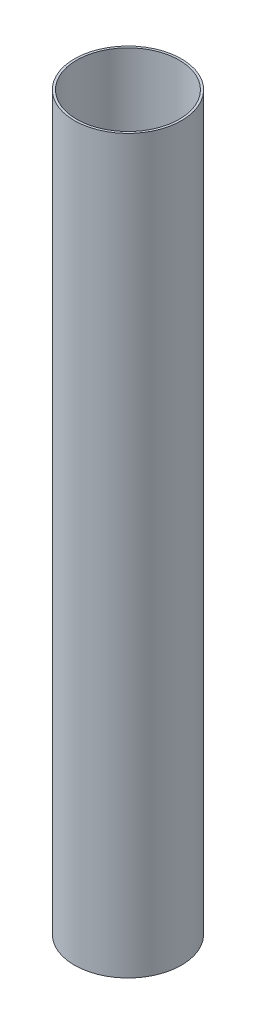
SolidWorks part; units mm, degrees
ref_plane "Front Plane" through (0, 0, 0) normal (0, 0, 1) x (1, 0, 0)
ref_plane "Top Plane" through (0, 0, 0) normal (0, 1, 0) x (1, 0, 0)
ref_plane "Right Plane" through (0, 0, 0) normal (1, 0, 0) x (0, 0, -1)
sketch "Sketch1" plane through (0, 0, 0) normal (0, 1, 0) x (1, 0, 0)
  circle A0 centre (0, 0) radius 76.2
  circle A1 centre (0, 0) radius 73.025
  dimension "D1" = 152.4
  dimension "D2" = 3.175
extrude "Boss-Extrude1" add sketch "Sketch1" along normal blind 1041.4
